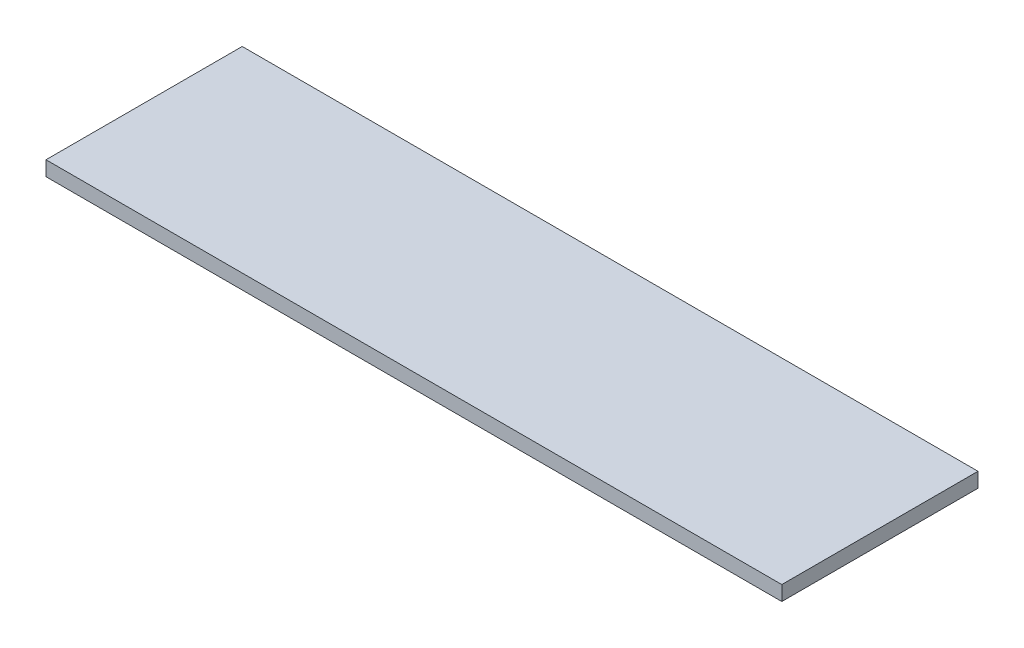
SolidWorks part; units mm, degrees
ref_plane "Front Plane" through (0, 0, 0) normal (0, 0, 1) x (1, 0, 0)
ref_plane "Top Plane" through (0, 0, 0) normal (0, 1, 0) x (1, 0, 0)
ref_plane "Right Plane" through (0, 0, 0) normal (1, 0, 0) x (0, 0, -1)
sketch "Sketch1" plane through (0, 0, 0) normal (0, 1, 0) x (1, 0, 0)
  line L1 (-75, 20) -> (75, 20)
  line L2 (-75, 20) -> (-75, -20)
  line L3 (-75, -20) -> (75, -20)
  line L4 (75, 20) -> (75, -20)
  line L5 (-75, 20) -> (75, -20) construction
  line L6 (-75, -20) -> (75, 20) construction
  point P0 (0, 0)
  dimension "D1" = 150
  dimension "D2" = 40
extrude "Boss-Extrude1" add sketch "Sketch1" along normal blind 3
equation "\"sheet thickness\"= 3mm"
equation "\"D1@Boss-Extrude1\"=\"sheet thickness\""
